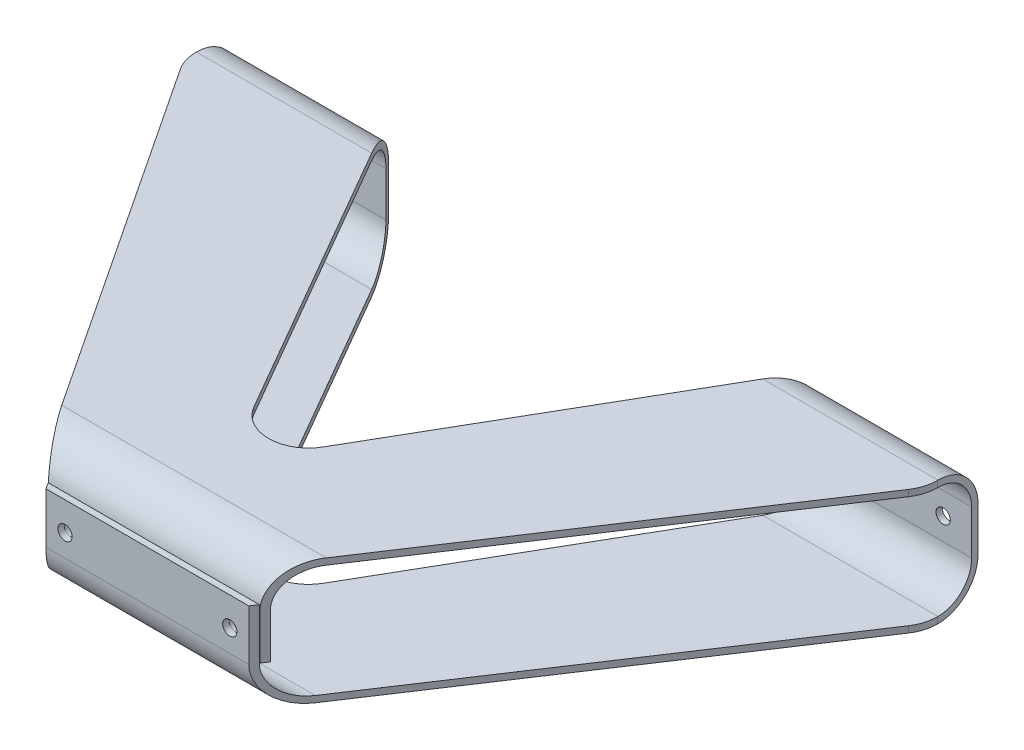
SolidWorks part; units mm, degrees
ref_plane "Front Plane" through (0, 0, 0) normal (1, 0, 0) x (0, 1, 0)
ref_plane "Top Plane" through (0, 0, 0) normal (0, 0, 1) x (0, 1, 0)
ref_plane "Right Plane" through (0, 0, 0) normal (0, 1, 0) x (-1, 0, 0)
sketch "Sketch1" plane through (0, 0, 0) normal (1, 0, 0) x (0, 1, 0)
  line L12 (28.575, 230.365) -> (-22.225, 230.365)
  line L13 (-62.325, 190.265) -> (-62.325, -190.265)
  line L14 (-22.225, -230.365) -> (22.225, -230.365)
  line L15 (62.325, -190.265) -> (62.325, 183.661)
  line L16 (22.225, 223.761) -> (-22.225, 223.761)
  line L17 (28.575, 224.015) -> (-22.225, 224.015)
  line L18 (0, -230.365) -> (0, 281.6021) construction
  line L19 (-55.975, 190.265) -> (-55.975, -190.265)
  line L20 (-22.225, -224.015) -> (22.225, -224.015)
  line L21 (55.975, -190.265) -> (55.975, 183.661)
  line L22 (22.225, 217.411) -> (-22.225, 217.411)
  line L23 (28.575, 230.365) -> (28.575, 224.015)
  line L24 (-22.225, 223.761) -> (-22.225, 217.411)
  arc A8 (-62.325, -190.265) -> (-22.225, -230.365) centre (-22.225, -190.265) ccw
  arc A9 (22.225, -230.365) -> (62.325, -190.265) centre (22.225, -190.265) ccw
  arc A10 (62.325, 183.661) -> (22.225, 223.761) centre (22.225, 183.661) ccw
  arc A11 (-22.225, 230.365) -> (-62.325, 190.265) centre (-22.225, 190.265) ccw
  circle A12 centre (0, 257.8912) radius 7.1438 construction
  circle A13 centre (0, 257.8912) radius 16.51 construction
  arc A17 (-22.225, 224.015) -> (-55.975, 190.265) centre (-22.225, 190.265) ccw
  arc A18 (-55.975, -190.265) -> (-22.225, -224.015) centre (-22.225, -190.265) ccw
  arc A19 (22.225, -224.015) -> (55.975, -190.265) centre (22.225, -190.265) ccw
  arc A20 (55.975, 183.661) -> (22.225, 217.411) centre (22.225, 183.661) ccw
  point P16 (0, -230.365)
  point P17 (-62.325, 0)
  point P22 (7.1438, 257.8912)
  dimension "D1" = 40.1
  dimension "D5" = 14.2875
  dimension "D6" = 33.02
  dimension "D7" = 21.4313
  dimension "D8" = 6.35
  dimension "D2" = 460.73
  dimension "D3" = 44.45
  dimension "D4" = 6.35
  dimension "D9" = 0.254
extrude "Main bdy" add sketch "Sketch1" along normal mid plane 742.95
sketch "Sketch2" plane through (0, 0, -230.365) normal (0, 0, -1) x (1, 0, 0)
  line L0 (-304.8, 0) -> (-304.8, 114.1742) construction
  line L1 (-304.8, 114.1742) -> (304.8, 114.1742) construction
  line L2 (304.8, 114.1742) -> (304.8, 0) construction
  point P3 (0, 114.1742)
  line B0 (-342.9, 0) -> (-266.7, 0) construction
  circle B1 centre (-342.9, 0) radius 7.1438
  circle B2 centre (-266.7, 0) radius 7.1438
  line B3 (266.7, 0) -> (342.9, 0) construction
  circle B4 centre (266.7, 0) radius 7.1438
  circle B5 centre (342.9, 0) radius 7.1438
  dimension "D1" = 609.6
sketch_block_instance "Upper bolt holes-1"
sketch_block "Upper bolt holes" parameters "D1"=14.2875, "D2"=14.2875, "D3"=76.2
sketch_block_instance "Upper bolt holes-2"
sketch "Sketch3" plane through (0, 0, 0) normal (0, 1, 0) x (-1, 0, 0)
  line L0 (-418.0368, -247.9456) -> (-101.6, 230.365)
  line L1 (-101.6, 230.365) -> (-418.0368, 230.365)
  line L2 (-418.0368, 230.365) -> (-418.0368, -247.9456)
  line L3 (101.6, 230.365) -> (417.0946, 230.365)
  line L4 (417.0946, 230.365) -> (417.0946, -246.5214)
  line L5 (417.0946, -246.5214) -> (101.6, 230.365)
  line L6 (-101.6, 230.365) -> (-101.6, 339.2736) construction
  line L7 (-101.6, 339.2736) -> (101.6, 339.2736) construction
  line L8 (101.6, 339.2736) -> (101.6, 230.365) construction
  line L9 (-371.475, -190.265) -> (-371.475, 183.661) construction
  line L10 (-371.475, -190.265) -> (371.475, -190.265) construction
  line L11 (371.475, -190.265) -> (371.475, 183.661) construction
  line L12 (-371.475, 230.365) -> (371.475, 230.365) construction
  point P5 (0, 339.2736)
  point P12 (-371.475, -177.565)
  point P17 (371.475, -177.565)
  dimension "D1" = 203.2
  dimension "D2" = 12.7
  dimension "D3" = 12.7
extrude "Side Angle" cut sketch "Sketch3" against normal through all both and the other way through all
fillet "Fillet1" radius 40 4 edges at (-371.475, -59.15, -177.565) (-371.475, 59.15, -177.565) (371.475, 59.15, -177.565) (371.475, -59.15, -177.565)
extrude "Lwr Bolt holes" cut sketch "Sketch2" against normal blind 10 and the other way through all
sketch "Sketch4" plane through (0, 0, 0) normal (0, 1, 0) x (-1, 0, 0)
  line L0 (-101.6, 230.365) -> (101.6, 230.365) construction
  line L1 (101.6, 230.365) -> (101.6, 273.0564)
  line L2 (-101.6, 230.365) -> (-101.6, 288.6125)
  circle A0 centre (-82.55, 262.4802) radius 19.05
  circle A1 centre (82.55, 262.4802) radius 19.05
  circle A2 centre (-82.55, 262.4802) radius 7.1438
  circle A3 centre (82.55, 262.4802) radius 7.1438
  line B0 (127, 230.365) -> (-127, 230.365)
  line B1 (127, 230.365) -> (127, 296.405)
  line B2 (0, 230.365) -> (0, 246.4501) construction
  line B3 (-103.6142, 236.461) -> (103.6142, 236.461)
  line B4 (112.1327, 243.6771) -> (120.426, 293.4336)
  dimension "D1" = 38.1
  dimension "D2" = 38.1
  dimension "D3" = 14.2875
sketch_block_instance "C10 x 15.3-1"
sketch_block "C10 x 15.3" parameters "D3"=8.636, "D6"=3.556, "D1"=254, "D2"=66.04, "D4"=6.096, "D5"=9.463, "D7"=3.0664, "D8"=16.0851
sketch "Sketch5"
sketch_block_instance "Block1-1"
sketch_block "Block1" parameters "D1"=20.4939, "D2"=19.0707
extrude "Upper Bolts outer" cut sketch "Sketch5" against normal blind 15
sketch "Sketch6" plane through (0, 0, 223.761) normal (0, 0, 1) x (1, 0, 0)
  circle A8 centre (-82.55, 0) radius 8.1438
  circle A9 centre (82.55, 0) radius 8.1438
  circle A10 centre (82.55, 0) radius 7.1438 construction
  circle A11 centre (-82.55, 0) radius 7.1438 construction
  point P6 (-82.55, 7.1437)
  point P7 (-82.55, 8.1437)
  point P8 (82.55, 8.1437)
  point P10 (-82.55, -8.1437)
  point P14 (-82.55, -7.1438)
  dimension "D3" = 16.2875
  dimension "D1" = 1
extrude "Upper Bolts Inner" cut sketch "Sketch6" against normal blind 15
sketch "Sketch7" plane through (0, 0, 0) normal (0, 1, 0) x (-1, 0, 0)
  line L0 (-34.7276, 88.934) -> (-219.075, -230.365)
  line L1 (-219.075, -230.365) -> (219.075, -230.365)
  line L2 (34.7276, 88.934) -> (219.075, -230.365)
  line L3 (-371.475, -230.365) -> (371.475, -230.365) construction
  arc A0 (-34.7276, 88.934) -> (34.7276, 88.934) centre (0, 68.884) cw
  dimension "D3" = 40.1
  dimension "D1" = 152.4
  dimension "D2" = 152.4
  dimension "D4" = 60
  dimension "D5" = 60
extrude "Center cut" cut sketch "Sketch7" against normal through all both and the other way through all
